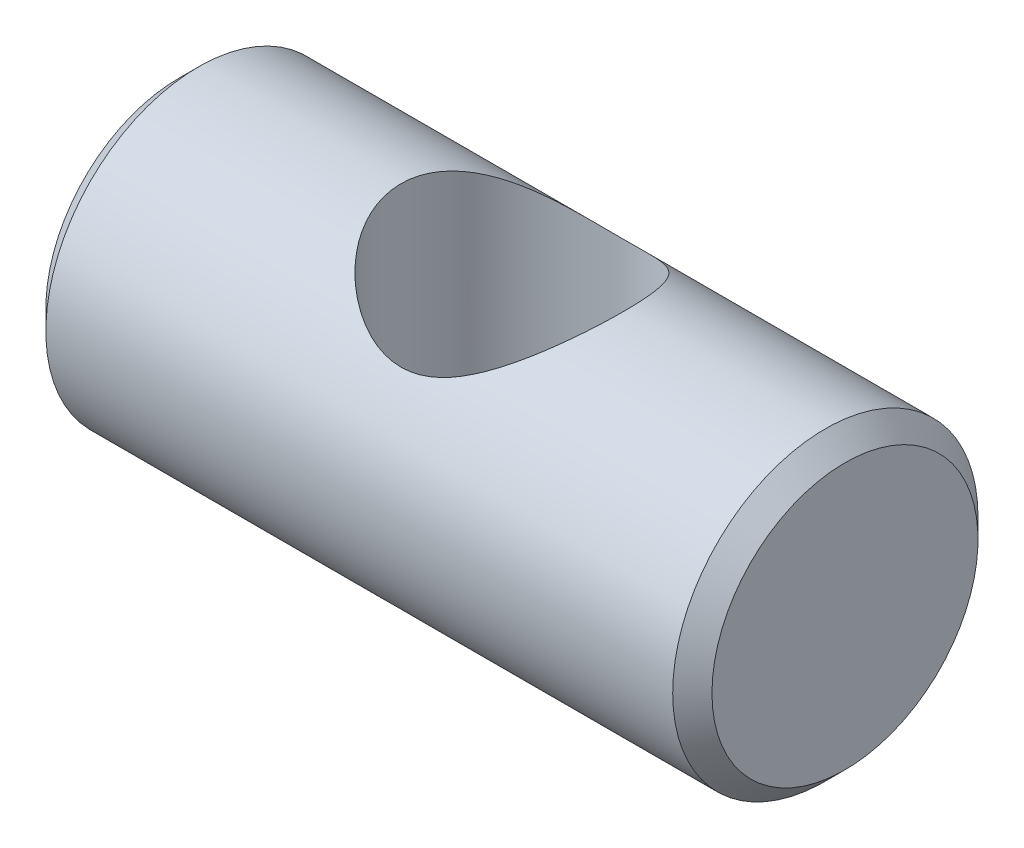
SolidWorks part; units mm, degrees
ref_plane "Front" through (0, 0, 0) normal (0, 0, 1) x (1, 0, 0)
ref_plane "Top" through (0, 0, 0) normal (0, 1, 0) x (1, 0, 0)
ref_plane "Right" through (0, 0, 0) normal (1, 0, 0) x (0, 0, -1)
imported_body "Imported1"
sketch "Sketch1" plane through (0, 0, 0) normal (0, 1, 0) x (1, 0, 0)
  circle A0 centre (0, 0) radius 4
extrude "Extrude1" cut sketch "Sketch1" against normal through all both and the other way through all
